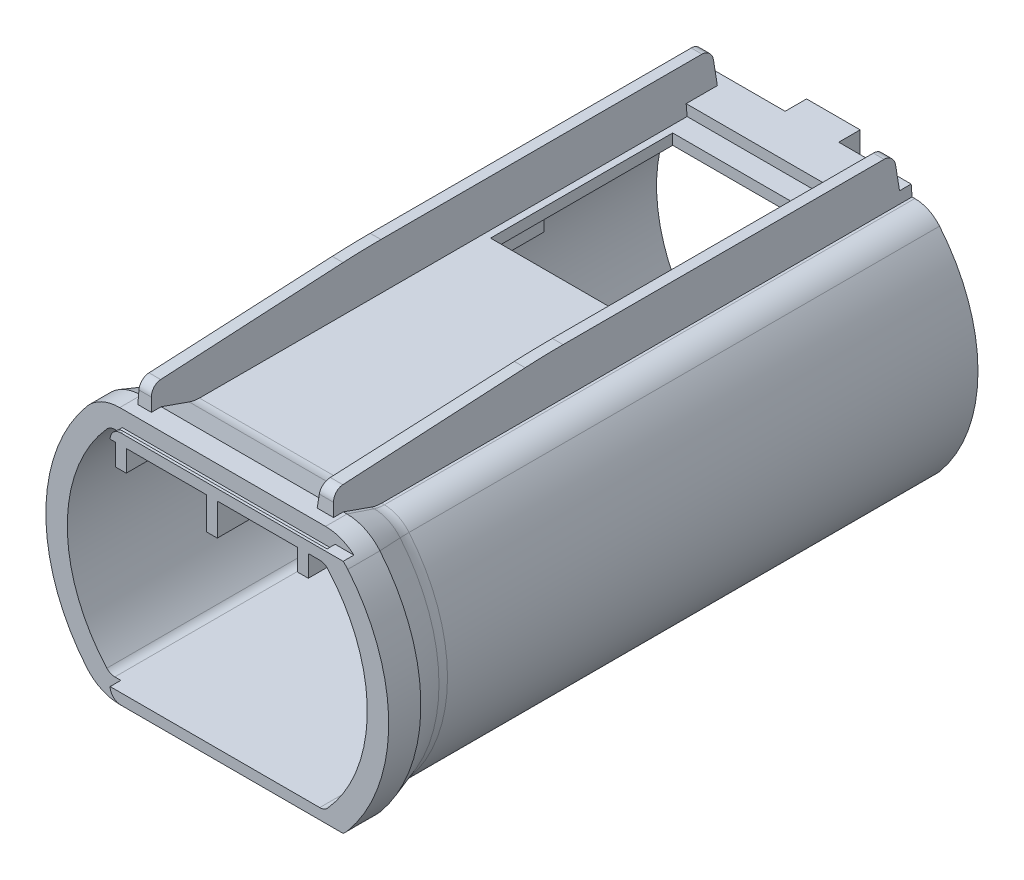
SolidWorks part; units mm, degrees
ref_plane "Front Plane" through (0, 0, 0) normal (0, 0, 1) x (1, 0, 0)
ref_plane "Top Plane" through (0, 0, 0) normal (0, 1, 0) x (1, 0, 0)
ref_plane "Right Plane" through (0, 0, 0) normal (1, 0, 0) x (0, 0, -1)
sketch "Sketch1" plane through (0, 0, 0) normal (0, 0, 1) x (1, 0, 0)
  line L0 (0, -10) -> (0, 10) construction
  line L1 (-10.5, 10) -> (10.5, 10)
  line L2 (14.5, 0) -> (14.5, 10) construction
  line L3 (-10.5, -10) -> (10.5, -10)
  line L4 (10.5, 10) -> (10.5, -10) construction
  line L5 (-14.5, 0) -> (-14.5, 15.1719) construction
  arc A0 (10.5, -10) -> (10.5, 10) centre (0, 0) ccw
  arc A1 (-10.5, 10) -> (-10.5, -10) centre (0, 0) ccw
  point P8 (0, 0)
  dimension "D1" = 29
  dimension "D2" = 20
extrude "Extrude-Thin2" add sketch "Sketch1" along normal blind 53 thin
fillet "Fillet3" radius 1 4 edges at (10.5, -10, 26.5) (-10.5, -10, 26.5) (-10.5, 10, 26.5) (10.5, 10, 26.5)
fillet "Fillet4" radius 3 4 edges at (10.9202, -11, 26.5) (10.9202, 11, 26.5) (-10.9202, -11, 26.5) (-10.9202, 11, 26.5)
ref_plane "Plane2" through (0, 0, 56) normal (0, 0, 1) x (1, 0, 0)
sketch "Sketch27" plane through (0, 0, 53) normal (0, 0, 1) x (1, 0, 0)
  circle A0 centre (0, 0) radius 21.9056
extrude "Extrude13" add sketch "Sketch27" along normal blind 2
chamfer "Chamfer1" distance 3 distance2 1 8 edges at (0, -11, 53) (10.8775, -10.7166, 53) (-10.8775, -10.7166, 53) (15.5, 0, 53) (-15.5, 0, 53) (10.8775, 10.7166, 53) (-10.8775, 10.7166, 53) (0, 11, 53)
ref_plane "Plane4" through (0, 0, 53) normal (0, 0, -1) x (-1, 0, 0)
other "SurfaceCut1"
fillet "Fillet6" radius 3 8 edges at (-10.8775, 10.7166, 50) (-10.8775, -10.7166, 50) (0, -11, 50) (10.8775, -10.7166, 50) (15.5, 0, 50) (10.8775, 10.7166, 50) (0, 11, 50) (-15.5, 0, 50)
sketch "Sketch8" plane through (0, 11, 0) normal (0, 1, 0) x (-1, 0, 0)
  line L1 (9, 0) -> (-9, 0)
  line L2 (9, 0) -> (9, 4)
  line L3 (9, 4) -> (-9, 4)
  line L4 (-9, 0) -> (-9, 4)
  line L5 (-9.6047, 0) -> (9.6047, 0) construction
  point P6 (0, 4)
  dimension "D1" = 18
  dimension "D2" = 4
extrude "Extrude7" add sketch "Sketch8" along normal blind 1
sketch "Sketch28" plane through (0, 0, 53) normal (0, 0, 1) x (1, 0, 0)
  line L0 (10.0623, 10) -> (-10.0623, 10) construction
  line L1 (-10.0623, -10) -> (10.0623, -10) construction
  line L2 (9.6047, 12) -> (-9.6047, 12)
  line L3 (9.6047, 12) -> (-9.6047, 12)
  line L4 (-9.6047, -12) -> (9.6047, -12)
  line L5 (-9.6047, -12) -> (9.6047, -12)
  line L6 (10.0623, 10) -> (-10.0623, 10)
  line L7 (-10.0623, -10) -> (10.0623, -10)
  arc A0 (10.0623, -10) -> (10.8077, -9.6667) centre (10.0623, -9) ccw construction
  arc A1 (10.8077, -9.6667) -> (10.8077, 9.6667) centre (0, 0) ccw construction
  arc A2 (10.8077, 9.6667) -> (10.0623, 10) centre (10.0623, 9) ccw construction
  arc A3 (-10.0623, 10) -> (-10.8077, 9.6667) centre (-10.0623, 9) ccw construction
  arc A4 (-10.8077, 9.6667) -> (-10.8077, -9.6667) centre (0, 0) ccw construction
  arc A5 (-10.8077, -9.6667) -> (-10.0623, -10) centre (-10.0623, -9) ccw construction
  arc A6 (10.0623, -10) -> (10.8077, -9.6667) centre (10.0623, -9) ccw
  arc A7 (10.8077, -9.6667) -> (10.8077, 9.6667) centre (0, 0) ccw
  arc A8 (12.6782, 10.56) -> (9.6047, 12) centre (9.6047, 8) ccw
  arc A9 (12.6782, 10.56) -> (9.6047, 12) centre (9.6047, 8) ccw
  arc A10 (-9.6047, 12) -> (-12.6782, 10.56) centre (-9.6047, 8) ccw
  arc A11 (-9.6047, 12) -> (-12.6782, 10.56) centre (-9.6047, 8) ccw
  arc A12 (-12.6782, -10.56) -> (-9.6047, -12) centre (-9.6047, -8) ccw
  arc A13 (-12.6782, -10.56) -> (-9.6047, -12) centre (-9.6047, -8) ccw
  arc A14 (-12.6782, 10.56) -> (-12.6782, -10.56) centre (0, 0) ccw
  arc A15 (-12.6782, 10.56) -> (-12.6782, -10.56) centre (0, 0) ccw
  arc A16 (9.6047, -12) -> (12.6782, -10.56) centre (9.6047, -8) ccw
  arc A17 (9.6047, -12) -> (12.6782, -10.56) centre (9.6047, -8) ccw
  arc A18 (12.6782, -10.56) -> (12.6782, 10.56) centre (0, 0) ccw
  arc A19 (12.6782, -10.56) -> (12.6782, 10.56) centre (0, 0) ccw
  arc A24 (10.8077, 9.6667) -> (10.0623, 10) centre (10.0623, 9) ccw
  arc A25 (-10.0623, 10) -> (-10.8077, 9.6667) centre (-10.0623, 9) ccw
  arc A26 (-10.8077, 9.6667) -> (-10.8077, -9.6667) centre (0, 0) ccw
  arc A27 (-10.8077, -9.6667) -> (-10.0623, -10) centre (-10.0623, -9) ccw
  dimension "D1" = 0
extrude "Extrude14" add sketch "Sketch28" along normal blind 3
sketch "Sketch9" plane through (9, 0, 0) normal (1, 0, 0) x (0, 0, -1)
  line L0 (-1, 11) -> (-1.35, 15)
  line L2 (-54, 11) -> (-53.7375, 14)
  line L3 (-53.7375, 14) -> (-35.7699, 14.9103)
  line L4 (-32.2279, 15) -> (-1.35, 15)
  line L5 (-54, 11) -> (-1, 11)
  line L6 (-1, 11) -> (-1, 22.6172) construction
  line L7 (-54, 11) -> (-54, 21.6834) construction
  arc A0 (-35.7699, 14.9103) -> (-32.2279, 15) centre (-32.2279, -55) cw
  point P15 (-34, 15)
  dimension "D8" = 70
  dimension "D1" = 5
  dimension "D2" = 5
  dimension "D3" = 4
  dimension "D7" = 3
extrude "Extrude8" add sketch "Sketch9" against normal blind 1
draft "Draft1" type of draft neutral plane draft angle 5 faces to draft 2 parameters "D1"=5
fillet "Fillet5" radius 1 2 edges at (8.5, 15, 1.35) (8.5, 14, 53.7375)
mirror "Mirror2" about plane through (0, 0, 0) normal (1, 0, 0) of "Fillet5", "Draft1", "Extrude8"
sketch "Sketch14" plane through (0, 0, 56) normal (0, 0, 1) x (1, 0, 0)
  line L12 (9.6047, 12) -> (-9.6047, 12) construction
  line L13 (-9.6047, -12) -> (9.6047, -12) construction
  line L16 (9.6047, 12) -> (-9.6047, 12)
  line L19 (-9.6047, -12) -> (9.6047, -12)
  line L20 (10.0623, 11) -> (-10.0623, 11)
  line L21 (12.2504, 11) -> (-8.5, 11)
  line L22 (-10.0623, 10) -> (-9.5, 10)
  line L23 (-10.0623, -11) -> (10.0623, -11)
  line L24 (-8.5, -11) -> (12.2504, -11)
  line L25 (10.0623, 10) -> (-10.0623, 10) construction
  line L26 (-10.0623, -10) -> (-9.5, -10)
  line L27 (-10.0623, -10) -> (10.0623, -10) construction
  line L28 (-9.5, -10) -> (-9.5, 10) construction
  arc A12 (-10.8077, -9.6667) -> (-10.0623, -10) centre (-10.0623, -9) ccw construction
  arc A13 (-10.8077, 9.6667) -> (-10.8077, -9.6667) centre (0, 0) ccw construction
  arc A14 (-10.0623, 10) -> (-10.8077, 9.6667) centre (-10.0623, 9) ccw construction
  arc A18 (12.6782, 10.56) -> (9.6047, 12) centre (9.6047, 8) ccw construction
  arc A19 (-9.6047, 12) -> (-12.6782, 10.56) centre (-9.6047, 8) ccw construction
  arc A20 (-12.6782, 10.56) -> (-12.6782, -10.56) centre (0, 0) ccw construction
  arc A21 (-12.6782, -10.56) -> (-9.6047, -12) centre (-9.6047, -8) ccw construction
  arc A22 (9.6047, -12) -> (12.6782, -10.56) centre (9.6047, -8) ccw construction
  arc A25 (-10.8077, -9.6667) -> (-10.0623, -10) centre (-10.0623, -9) ccw
  arc A26 (-10.8077, 9.6667) -> (-10.8077, -9.6667) centre (0, 0) ccw
  arc A27 (-10.0623, 10) -> (-10.8077, 9.6667) centre (-10.0623, 9) ccw
  arc A28 (12.2504, 11) -> (9.6047, 12) centre (9.6047, 8) ccw
  arc A29 (-9.6047, 12) -> (-12.6782, 10.56) centre (-9.6047, 8) ccw
  arc A30 (-12.6782, 10.56) -> (-12.6782, -10.56) centre (0, 0) ccw
  arc A31 (-12.6782, -10.56) -> (-9.6047, -12) centre (-9.6047, -8) ccw
  arc A32 (9.6047, -12) -> (12.2504, -11) centre (9.6047, -8) ccw
  arc A33 (-8.5, -11) -> (-9.5, -10) centre (-8.5, -10) cw
  arc A34 (-8.5, 11) -> (-9.5, 10) centre (-8.5, 10) ccw
  dimension "D3" = 7
  dimension "D1" = 1
  dimension "D2" = 1
extrude "Cut-Extrude3" cut sketch "Sketch14" against normal blind 1
sketch "Sketch15" plane through (0, -11, 0) normal (0, -1, 0) x (1, 0, 0)
  line L0 (-9.6047, 55) -> (9.6047, 55) construction
  line L1 (-9.5, 55) -> (10.5, 55)
  line L2 (-9.5, 55) -> (-9.5, 55.75)
  line L3 (-9.5, 55.75) -> (10.5, 55.75)
  line L4 (10.5, 55) -> (10.5, 55.75)
  line L8 (-9.5, 55) -> (-9.5, 56) construction
  dimension "D1" = 20
  dimension "D2" = 0.75
extrude "Cut-Extrude4" cut sketch "Sketch15" against normal blind 0.5
mirror "Mirror3" about plane through (0, 0, 0) normal (0, 1, 0) of "Cut-Extrude4"
sketch "Sketch16" plane through (0, 0, 56) normal (0, 0, 1) x (1, 0, 0)
  line L0 (8.5, 14.9103) -> (8.5, 4.0897) construction
  line L2 (-8.4961, 14.9103) -> (-8.4961, 3.833) construction
  line L7 (-8.4961, 10) -> (-8.4961, 8)
  line L9 (8.5, 8) -> (-8.4961, 8) construction
extrude "Extrude-Thin4" add sketch "Sketch16" against normal offset from surface (39 mm away) 17 thin
sketch "Sketch17" plane through (0, 0, 56) normal (0, 0, 1) x (1, 0, 0)
  line L0 (0, 0) -> (0, 10) construction
  line L2 (0, 10) -> (0, 7)
extrude "Extrude-Thin5" add sketch "Sketch17" against normal up to surface (39 mm away) thin
mirror "Mirror4" about plane through (0, 0, 0) normal (1, 0, 0) of "Extrude-Thin4"
sketch "Sketch18" plane through (0, 11, 0) normal (0, 1, 0) x (-1, 0, 0)
  line L0 (7.7375, 4) -> (-7.7375, 4) construction
  line L1 (-7.2461, 23) -> (6.9961, 23)
  line L4 (6.9961, 17) -> (6.9961, 56)
  line L5 (6.9961, 6) -> (6.9961, 23)
  line L6 (6.9961, 6) -> (-7.2461, 6)
  line L7 (-7.2461, 17) -> (-7.2461, 56)
  line L8 (-7.2461, 6) -> (-7.2461, 23)
  dimension "D3" = 19
  dimension "D4" = 17
  dimension "D1" = 1
  dimension "D2" = 0.75
extrude "Cut-Extrude5" cut sketch "Sketch18" against normal up to surface (4 mm away)
sketch "Sketch20" plane through (0, 0, 0) normal (0, 0, -1) x (-1, 0, 0)
  line L3 (2.5, 12) -> (2.5, 10)
  line L4 (2.5, 10) -> (-2.5, 10)
  line L5 (-2.5, 12) -> (-2.5, 10)
  line L6 (0, 0) -> (0, 10) construction
  line L7 (-2.5, 12) -> (2.5, 12)
  line L8 (-9.2625, 12) -> (9, 12) construction
  line L9 (-10.0623, 10) -> (10.0623, 10) construction
  dimension "D1" = 5
extrude "Extrude9" add sketch "Sketch20" along normal blind 2
ref_plane "Plane3" through (-5.5, 0, 0) normal (1, 0, 0) x (0, 0, -1)
sketch "Sketch21" plane through (-5.5, 0, 0) normal (1, 0, 0) x (0, 0, -1)
  line L0 (-13, -11) -> (-13.1187, -13.2658)
  line L1 (-49.5132, -11) -> (0, -11) construction
  line L2 (-18.8813, -13.2658) -> (-19, -11)
  line L3 (-19, -11) -> (-13, -11)
  line L4 (-16, -13.1148) -> (-16, 4.3405) construction
  line L6 (0, -9.92) -> (0, 9.92) construction
  arc A0 (-13.1187, -13.2658) -> (-18.8813, -13.2658) centre (-16, -13.1148) cw
  dimension "D2" = 5
  dimension "D1" = 6
  dimension "D3" = 3
  dimension "D4" = 16
extrude "Extrude10" add sketch "Sketch21" along normal blind 1
sketch "Sketch22" plane through (-5.5, 0, 0) normal (-1, 0, 0) x (0, 0, 1)
  circle A0 centre (16, -13.1148) radius 1
  dimension "D1" = 2
extrude "Cut-Extrude6" cut sketch "Sketch22" against normal through all
mirror "Mirror5" about plane through (0, 0, 0) normal (1, 0, 0) of "Cut-Extrude6", "Extrude10"
sketch "Sketch24" plane through (-4.5, 0, 0) normal (1, 0, 0) x (0, 0, -1)
  line L0 (-13.1187, -13.2658) -> (-13, -11) construction
  line L1 (-13, -11) -> (-19, -11) construction
  line L2 (-13.1187, -13.2658) -> (-13, -11)
  line L3 (-13, -11) -> (-13.7375, -11)
  line L4 (-13.1187, -13.2658) -> (-13.6187, -13.2658)
  line L5 (-13.6187, -13.2658) -> (-13.7375, -11)
  line L6 (-13.3687, -13.2658) -> (-13.3687, -8.7697) construction
  dimension "D1" = 0.5
extrude "Extrude11" add sketch "Sketch24" along normal blind 4.5
sketch "Sketch26" plane through (-4.5, 0, 5.2625) normal (1, 0, 0) x (0, 0, -1)
  line L0 (-13.7375, -11) -> (-13.6187, -13.2658) construction
  line L2 (-13.1187, -13.2658) -> (-13, -11)
  line L3 (-13, -11) -> (-13.7375, -11)
  line L4 (-13.1187, -13.2658) -> (-13.6187, -13.2658)
  line L5 (-13.6187, -13.2658) -> (-13.7375, -11)
  line L6 (-13.3687, -13.2658) -> (-13.3687, -8.7697) construction
extrude "Extrude12" add sketch "Sketch26" along normal up to surface (9 mm away)
